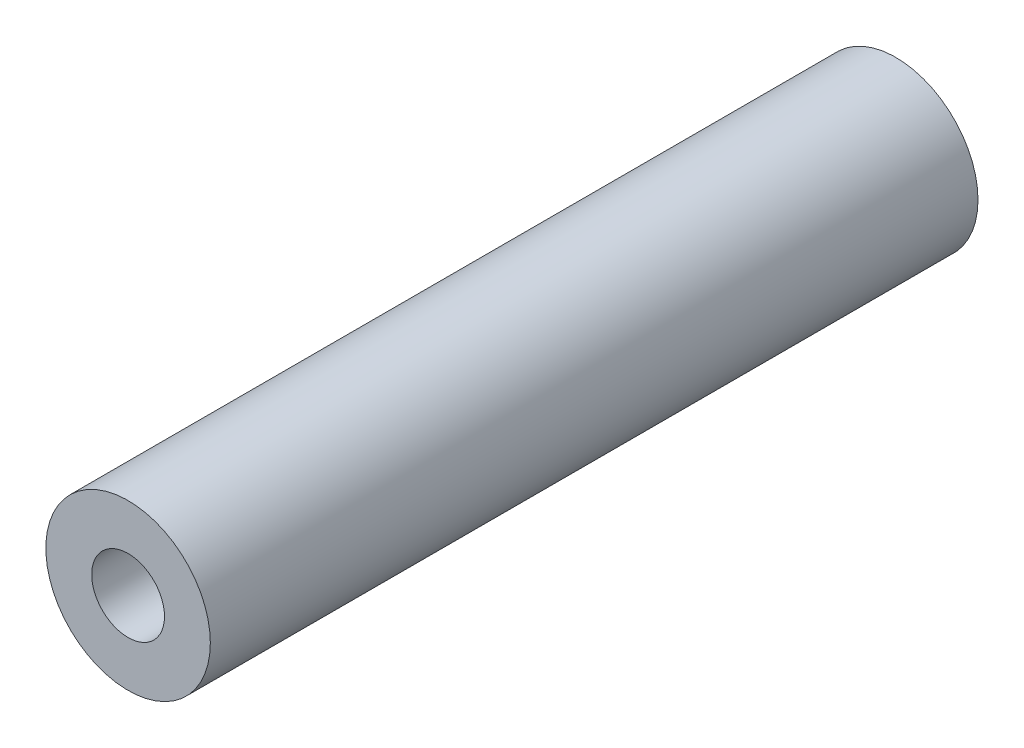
SolidWorks part; units mm, degrees
ref_plane "Front Plane" through (0, 0, 0) normal (0, 0, 1) x (1, 0, 0)
ref_plane "Top Plane" through (0, 0, 0) normal (0, 1, 0) x (1, 0, 0)
ref_plane "Right Plane" through (0, 0, 0) normal (1, 0, 0) x (0, 0, -1)
sketch "Sketch1" plane through (0, 0, 0) normal (0, 0, 1) x (1, 0, 0)
  circle A0 centre (0, 0) radius 4.7625
  circle A1 centre (0, 0) radius 2.1082
  dimension "OD" = 9.525
  dimension "ID" = 4.2164
extrude "Extrude1" add sketch "Sketch1" along normal mid plane 44.45
sketch "Sketch2" plane through (0, 0, 0) normal (1, 0, 0) x (0, 0, -1)
  line L0 (-22.225, -2.1082) -> (22.225, -2.1082) construction
  line L3 (22.225, 2.1082) -> (-22.225, 2.1082) construction
  line L5 (-22.225, -2.1082) -> (22.225, -2.1082)
  line L6 (22.225, 2.1082) -> (-22.225, 2.1082)
sketch "Sketch4" plane through (0, 0, 22.225) normal (0, 0, 1) x (1, 0, 0)
  line L0 (0, 0) -> (-1.4907, 1.4907)
  line L1 (0, -5.2388) -> (0, 5.2388) construction
  circle A0 centre (0, 0) radius 2.1082 construction
  dimension "D1" = 45
